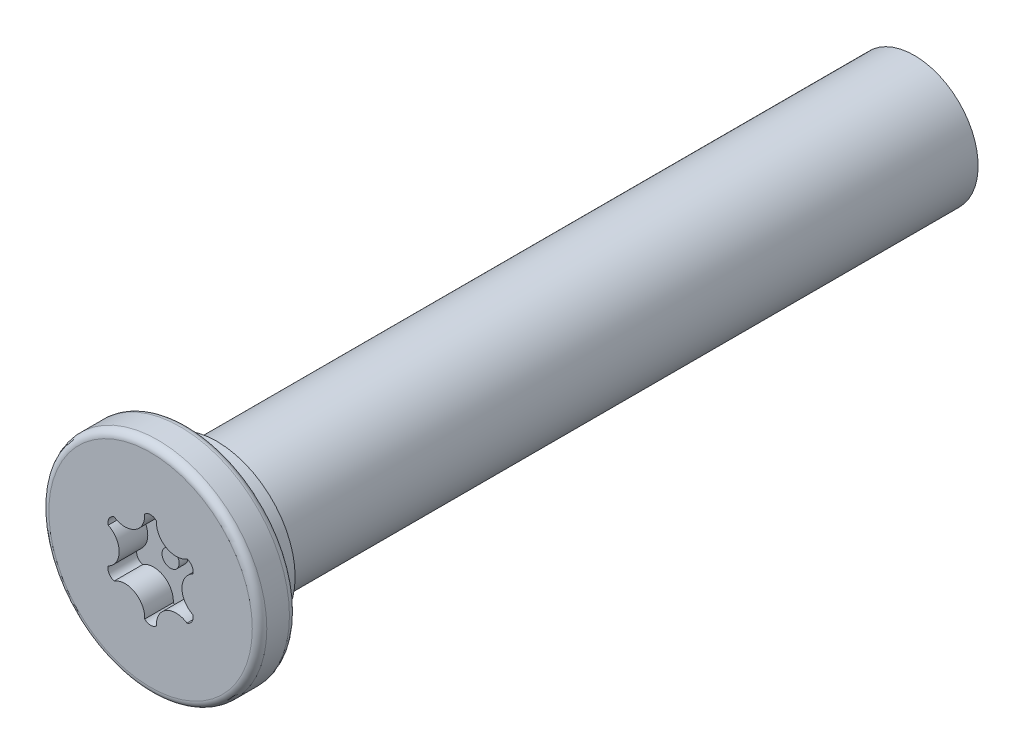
SolidWorks part; units mm, degrees
ref_plane "Front Plane" through (0, 0, 0) normal (0, 0, 1) x (1, 0, 0)
ref_plane "Top Plane" through (0, 0, 0) normal (0, 1, 0) x (1, 0, 0)
ref_plane "Right Plane" through (0, 0, 0) normal (1, 0, 0) x (0, 0, -1)
sketch "Sketch2" plane through (0, 0, 0) normal (1, 0, 0) x (0, 0, -1)
  line L1 (0, 0) -> (1.3, 0)
  line L2 (0, 0) -> (0, 3.81)
  line L3 (0, 3.81) -> (1.3, 3.81)
  line L4 (1.3, 0) -> (1.3, 3.81)
  line L5 (1.3, 0) -> (14, 0)
  line L6 (1.3, 0) -> (1.3, 2.23)
  line L7 (1.3, 2.23) -> (14, 2.23)
  line L8 (14, 0) -> (14, 2.23)
  dimension "D1" = 3.81
  dimension "D2" = 1.3
  dimension "D3" = 12.7
  dimension "D4" = 2.23
revolve "Revolve1" add sketch "Sketch2" angle 360 about L5
sketch "Sketch3" plane through (0, 0, 0) normal (0, 0, 1) x (1, 0, 0)
  line L0 (0, 1.3843) -> (0, 0)
  line L3 (1.1845, -1.0048) -> (2.4257, -1.0048)
  line L4 (0, 1.675) -> (0, 1.6727)
  line L5 (0, 1.675) -> (0, 1.6727)
  line L6 (0, 1.6727) -> (0, 1.675)
  line L8 (1.0407, 1.8026) -> (1.1012, 1.9073)
  line L9 (1.3857, 1.205) -> (2.5818, 1.205)
  line L10 (0, 0) -> (0.8375, 1.4506)
  line L11 (0, 0) -> (2.5818, 0)
  line L14 (2.5818, 0) -> (2.5818, 1.205)
  line L15 (1.3857, 1.205) -> (-0.1691, 1.205)
  circle A0 centre (0, 0) radius 1.675
  arc A7 (1.1845, -1.0048) -> (1.0345, -1.0748) centre (0.8546, -0.4934) cw
  arc A16 (-0.2051, 1.5894) -> (0.2051, 1.5894) centre (0, 1.3843) cw
  arc A18 (0.2051, 1.5894) -> (1.2739, 0.9723) centre (0.8938, 1.5482) ccw
  arc A19 (1.479, 0.6171) -> (1.479, -0.6171) centre (1.7877, 0) ccw
  arc A20 (1.2739, 0.9723) -> (1.479, 0.6171) centre (1.1988, 0.6922) cw
  arc A21 (1.2739, -0.9723) -> (0.2051, -1.5894) centre (0.8938, -1.5482) ccw
  arc A22 (1.479, -0.6171) -> (1.2739, -0.9723) centre (1.1988, -0.6922) cw
  arc A23 (-0.2051, -1.5894) -> (-1.2739, -0.9723) centre (-0.8938, -1.5482) ccw
  arc A24 (0.2051, -1.5894) -> (-0.2051, -1.5894) centre (0, -1.3843) cw
  arc A25 (-1.479, -0.6171) -> (-1.479, 0.6171) centre (-1.7877, 0) ccw
  arc A26 (-1.2739, -0.9723) -> (-1.479, -0.6171) centre (-1.1988, -0.6922) cw
  arc A27 (-1.2739, 0.9723) -> (-0.2051, 1.5894) centre (-0.8938, 1.5482) ccw
  arc A28 (-1.479, 0.6171) -> (-1.2739, 0.9723) centre (-1.1988, 0.6922) cw
  point P38 (0, 0)
  point P52 (0, 0)
  dimension "D1" = 3.35
  dimension "D4" = 1.205
  dimension "D2" = 6
  dimension "D5" = 60
extrude "Cut-Extrude3" cut sketch "Sketch3" against normal blind 1
fillet "Fillet12" radius 0.254 2 edges at (3.81, 0, 0) (3.81, 0, -1.3)
sketch "Sketch7" plane through (0, 0, -14) normal (0, 0, -1) x (-1, 0, 0)
  circle A0 centre (0, 0) radius 2.23
  dimension "D1" = 4.46
extrude "Cut-Extrude6" cut sketch "Sketch7" against normal blind 12.7
sketch "Sketch11" plane through (0, 0, -1.3) normal (0, 0, -1) x (-1, 0, 0)
  circle A0 centre (0, 0) radius 2.23
  circle A1 centre (0, 0) radius 2.738
extrude "Boss-Extrude1" add sketch "Sketch11" along normal blind 1.016
sketch "Sketch12" plane through (0, 0, -1.3) normal (0, 0, -1) x (-1, 0, 0)
  circle A0 centre (0, 0) radius 2.23
extrude "Boss-Extrude2" add sketch "Sketch12" along normal blind 12.7
sketch "Sketch14" plane through (0, 0, -1) normal (0, 0, 1) x (1, 0, 0)
  circle A0 centre (0, 0) radius 0.3
extrude "Boss-Extrude4" add sketch "Sketch14" along normal blind 0.3
sketch "Sketch15" plane through (0, 0, -14) normal (0, 0, -1) x (-1, 0, 0)
  circle A0 centre (0, 0) radius 2.23
extrude "Cut-Extrude7" cut sketch "Sketch15" against normal blind 12.7
sketch "Sketch16" plane through (0, 0, -1.3) normal (0, 0, -1) x (-1, 0, 0)
  circle A0 centre (0, 0) radius 2.23
extrude "Boss-Extrude5" add sketch "Sketch16" along normal blind 25.4
